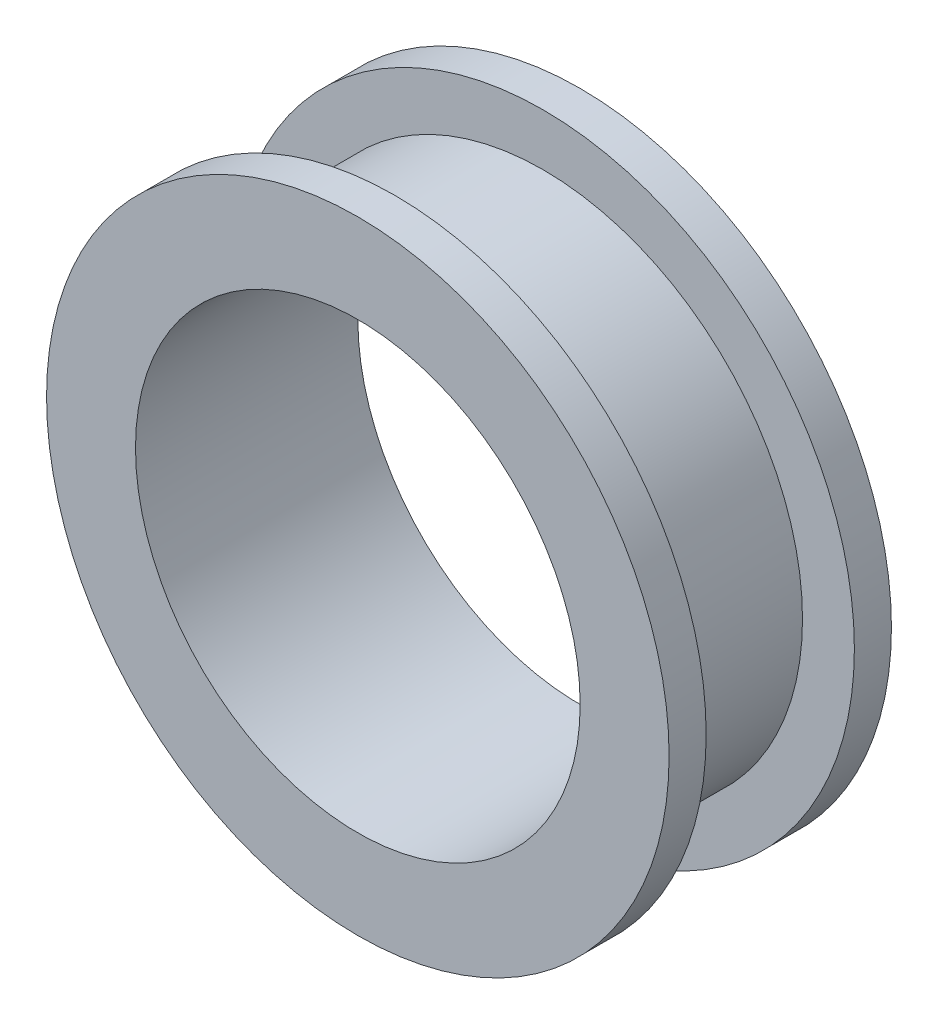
SolidWorks part; units mm, degrees
ref_plane "Front Plane" through (0, 0, 0) normal (0, 0, 1) x (1, 0, 0)
ref_plane "Top Plane" through (0, 0, 0) normal (0, 1, 0) x (1, 0, 0)
ref_plane "Right Plane" through (0, 0, 0) normal (1, 0, 0) x (0, 0, -1)
sketch "Sketch1" plane through (0, 0, 0) normal (1, 0, 0) x (0, 0, -1)
  line L0 (0, 0) -> (92.4402, 0) construction
  line L1 (0, 0) -> (0, 30) construction
  line L2 (10, 42) -> (15, 42)
  line L3 (15, 42) -> (15, 30)
  line L4 (15, 30) -> (-15, 30)
  line L5 (-15, 30) -> (-15, 42)
  line L6 (-15, 42) -> (-10, 42)
  line L7 (-10, 42) -> (-10, 35)
  line L8 (-10, 35) -> (10, 35)
  line L9 (10, 35) -> (10, 42)
  dimension "D2" = 20
  dimension "D1" = 30
  dimension "D3" = 12
  dimension "D4" = 30
  dimension "D5" = 5
  dimension "D6" = 5
revolve "Revolve1" add sketch "Sketch1" angle 360 about L0
